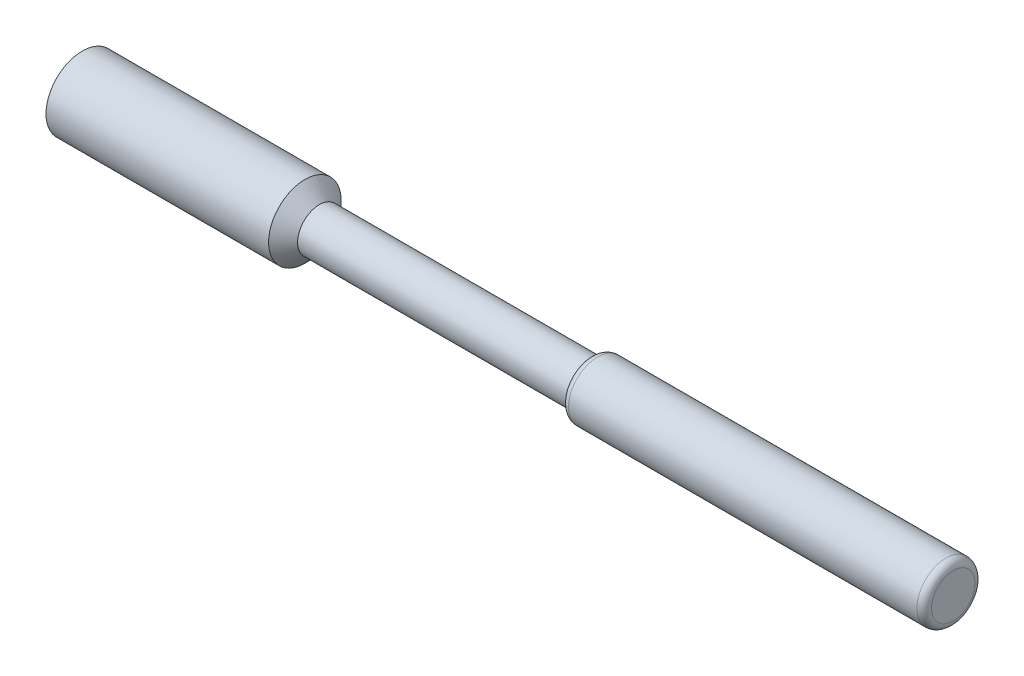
SolidWorks part; units mm, degrees
ref_plane "Front Plane" through (0, 0, 0) normal (0, 0, 1) x (1, 0, 0)
ref_plane "Top Plane" through (0, 0, 0) normal (0, 1, 0) x (1, 0, 0)
ref_plane "Right Plane" through (0, 0, 0) normal (1, 0, 0) x (0, 0, -1)
sketch "Sketch1" plane through (0, 0, 0) normal (1, 0, 0) x (0, 0, -1)
  circle A0 centre (0, 0) radius 7.5
  dimension "D1" = 15
extrude "Boss-Extrude1" add sketch "Sketch1" along normal blind 45
sketch "Sketch2" plane through (45, 0, 0) normal (1, 0, 0) x (0, 0, -1)
  circle A0 centre (0, 0) radius 4.5
  dimension "D1" = 9
extrude "Boss-Extrude2" add sketch "Sketch2" along normal blind 60
sketch "Sketch3" plane through (105, 0, 0) normal (1, 0, 0) x (0, 0, -1)
  circle A0 centre (0, 0) radius 6
  dimension "D1" = 12
extrude "Boss-Extrude3" add sketch "Sketch3" along normal blind 75
fillet "Fillet1" radius 1.5 2 edges at (180, 0, -6) (105, 0, -6)
chamfer "Chamfer2" distance 4 angle 45 1 edges at (45, 0, -4.5)
